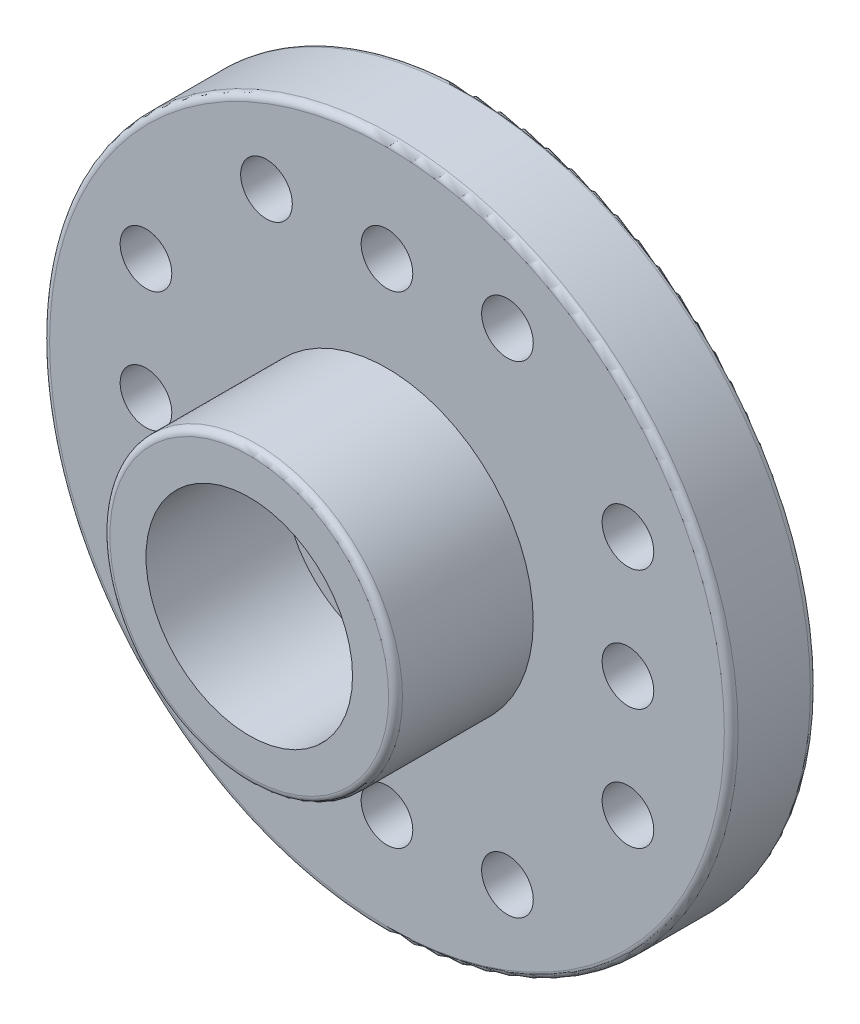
SolidWorks part; units mm, degrees
ref_plane "Front Plane" through (0, 0, 0) normal (0, 0, 1) x (1, 0, 0)
ref_plane "Top Plane" through (0, 0, 0) normal (0, 1, 0) x (1, 0, 0)
ref_plane "Right Plane" through (0, 0, 0) normal (1, 0, 0) x (0, 0, -1)
sketch "Sketch1" plane through (0, 0, 0) normal (0, 0, 1) x (1, 0, 0)
  line L0 (-7, 3.5) -> (-7, -3.5) construction
  line L1 (-7, 0) -> (0, 0) construction
  circle A0 centre (0, 0) radius 10
  circle A1 centre (-7, 0) radius 0.75
  circle A2 centre (3.5, 7) radius 0.75
  circle A3 centre (0, 7) radius 0.75
  circle A4 centre (-3.5, 7) radius 0.75
  circle A5 centre (7, -3.5) radius 0.75
  circle A6 centre (7, 0) radius 0.75
  circle A7 centre (7, 3.5) radius 0.75
  circle A8 centre (-3.5, -7) radius 0.75
  circle A9 centre (0, -7) radius 0.75
  circle A10 centre (3.5, -7) radius 0.75
  circle A11 centre (-7, -3.5) radius 0.75
  circle A13 centre (-7, 3.5) radius 0.75
  circle A22 centre (0, 0) radius 1.5
  point P25 (0, 0)
  dimension "D2" = 20
  dimension "D4" = 7
  dimension "D5" = 3.5
  dimension "D14" = 3
  dimension "D6" = 3.5
  dimension "D3" = 1.5
extrude "Boss-Extrude1" add sketch "Sketch1" along normal blind 2.5
sketch "Sketch5" plane through (0, 0, 2.5) normal (0, 0, 1) x (1, 0, 0)
  circle A0 centre (0, 0) radius 3
  circle A1 centre (0, 0) radius 4.25
  dimension "D1" = 8.5
extrude "Boss-Extrude2" add sketch "Sketch5" along normal blind 4
sketch "Sketch6" plane through (0, 0, 0) normal (0, 0, -1) x (-1, 0, 0)
  circle A0 centre (0, 0) radius 4.5
  dimension "D1" = 9
extrude "Cut-Extrude1" cut sketch "Sketch6" against normal blind 0.8
sketch "Sketch7" plane through (0, 0, 0.8) normal (0, 0, -1) x (-1, 0, 0)
  circle A0 centre (0.1627, 0) radius 3.5
  circle A1 centre (0.1627, 0) radius 3.7
  dimension "D1" = 7
  dimension "D2" = 0.2
extrude "Boss-Extrude3" add sketch "Sketch7" along normal blind 1
fillet "Fillet1" radius 0.2 4 edges at (10, 0, 0) (10, 0, 2.5) (-4.5, 0, 0) (4.25, 0, 6.5)
